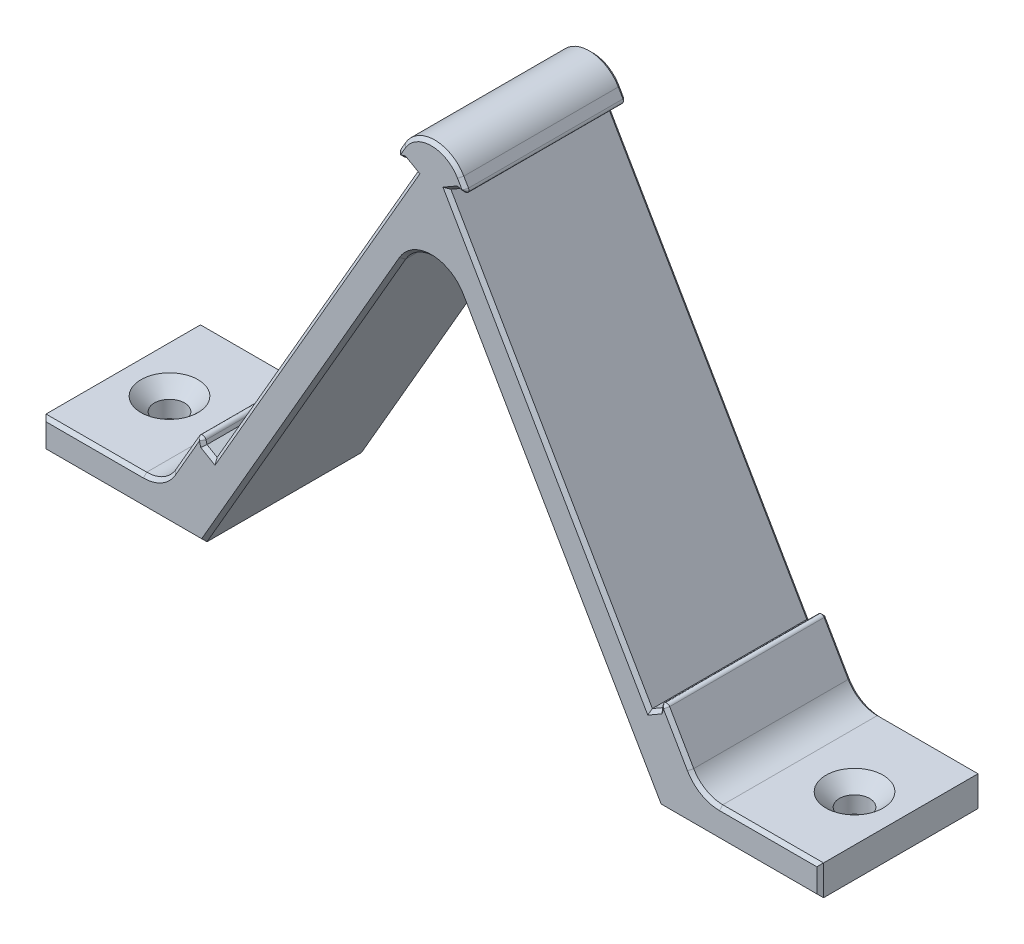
SolidWorks part; units mm, degrees
ref_plane "Plan de face" through (0, 0, 0) normal (0, 0, 1) x (1, 0, 0)
ref_plane "Plan de dessus" through (0, 0, 0) normal (0, 1, 0) x (1, 0, 0)
ref_plane "Plan de droite" through (0, 0, 0) normal (1, 0, 0) x (0, 0, -1)
sketch "Esquisse1" plane through (0, 0, 0) normal (0, 0, 1) x (1, 0, 0)
  line L0 (-38.5566, -6.1929) -> (-34.9786, 0.0045)
  line L1 (0, 60.5892) -> (0, 0) construction
  line L2 (17.4019, 24.4482) -> (23.4641, 27.9482) construction
  line L3 (39.3301, 2.4674) -> (2.4019, 50.4289) construction
  line L4 (-42.8868, -8.6929) -> (-57.8868, -8.6929)
  line L5 (9.3301, 54.4289) -> (32.4019, -1.5326) construction
  line L6 (-5.0214, 51.8918) -> (-4.3301, 53.0892)
  line L7 (33.9175, -0.6576) -> (32.4019, -1.5326)
  line L8 (-2.4019, 50.4289) -> (-32.4019, -1.5326)
  line L9 (-9.3301, 54.4289) -> (-32.4019, -1.5326) construction
  line L10 (-39.3301, 2.4674) -> (-2.4019, 50.4289) construction
  line L11 (-33.9175, -0.6576) -> (-34.0626, -0.116)
  line L12 (-17.4019, 24.4482) -> (-23.4641, 27.9482) construction
  line L13 (-3.9175, 51.3039) -> (-4.459, 51.1588)
  line L14 (-3.9175, 51.3039) -> (-2.4019, 50.4289)
  line L15 (-33.9175, -0.6576) -> (-32.4019, -1.5326)
  line L16 (3.9175, 51.3039) -> (2.4019, 50.4289)
  line L17 (3.9175, 51.3039) -> (4.459, 51.1588)
  line L18 (33.9175, -0.6576) -> (34.0626, -0.116)
  line L19 (2.4019, 50.4289) -> (32.4019, -1.5326)
  line L20 (5.0214, 51.8918) -> (4.3301, 53.0892)
  line L21 (42.8868, -8.6929) -> (57.8868, -8.6929)
  line L22 (38.5566, -6.1929) -> (34.9786, 0.0045)
  line L23 (-57.8868, -8.6929) -> (-57.8868, -13.1854)
  line L24 (-57.8868, -13.1854) -> (-33.9175, -13.1854)
  line L25 (-33.9175, -13.1854) -> (-4.3301, 38.0614)
  line L26 (4.3301, 38.0614) -> (33.9175, -13.1854)
  line L27 (33.9175, -13.1854) -> (57.8868, -13.1854)
  line L28 (57.8868, -13.1854) -> (57.8868, -8.6929)
  arc A0 (42.8868, -8.6929) -> (38.5566, -6.1929) centre (42.8868, -3.6929) cw
  arc A1 (-38.5566, -6.1929) -> (-42.8868, -8.6929) centre (-42.8868, -3.6929) cw
  arc A2 (4.3301, 53.0892) -> (-4.3301, 53.0892) centre (0, 50.5892) ccw
  arc A3 (-4.3301, 38.0614) -> (4.3301, 38.0614) centre (0, 35.5614) cw
  arc A4 (-34.0626, -0.116) -> (-34.9786, 0.0045) centre (-34.5455, -0.2455) ccw
  arc A5 (-5.0214, 51.8918) -> (-4.459, 51.1588) centre (-4.5884, 51.6418) ccw
  arc A6 (5.0214, 51.8918) -> (4.459, 51.1588) centre (4.5884, 51.6418) cw
  arc A7 (34.9786, 0.0045) -> (34.0626, -0.116) centre (34.5455, -0.2455) ccw
  point P7 (-20.866, 26.4482)
  point P28 (20.866, 26.4482)
  point P31 (40, -8.6929)
  point P34 (-40, -8.6929)
  point P45 (0, 45.5614)
  point P48 (-34.375, 1.0499)
  point P51 (-5.625, 50.8464)
  point P54 (5.625, 50.8464)
  point P57 (34.375, 1.0499)
  dimension "D2" = 5
  dimension "D8" = 5
  dimension "D9" = 0.5
  dimension "D10" = 0.5
  dimension "D11" = 0.5
  dimension "D12" = 0.5
  dimension "D1" = 80
  dimension "D3" = 60
  dimension "D4" = 3
  dimension "D5" = 1.75
  dimension "D6" = 45
  dimension "D7" = 40
  dimension "D13" = 15
extrude "Boss.-Extru.1" add sketch "Esquisse1" along normal mid plane 24
sketch "Esquisse2" plane through (0, -8.6929, 0) normal (0, 1, 0) x (1, 0, 0)
  line L0 (0, 0) -> (0, 27.2446) construction
  circle A0 centre (-51, 0) radius 2.25
  circle A1 centre (51, 0) radius 2.25
  dimension "D1" = 4.5
  dimension "D2" = 102
extrude "Enlèv. mat.-Extru.1" cut sketch "Esquisse2" against normal blind 24
chamfer "Chanfrein1" distance 2 angle 45 2 edges at (51, -8.6929, -2.25) (-51, -8.6929, 2.25)
chamfer "Chanfrein3" distance 0.5 angle 45 60 edges at (-45.9021, -13.1854, -12) (-19.1238, 12.438, -12) (0, 40.5614, -12) (19.1238, 12.438, -12) (45.9021, -13.1854, -12) (57.8868, -10.9391, -12) (50.3868, -8.6929, -12) (40.3868, -8.023, -12) (36.7676, -3.0942, -12) (34.4803, 0.2503, -12) (33.99, -0.3868, -12) (33.1597, -1.0951, -12) (17.4019, 24.4482, -12) (3.1597, 50.8664, -12) (4.1882, 51.2314, -12) (4.9851, 51.3374, -12) (4.6758, 52.4905, -12) (0, 55.5892, -12) (-4.6758, 52.4905, -12) (-4.9851, 51.3374, -12) (-4.1882, 51.2314, -12) (-3.1597, 50.8664, -12) (-17.4019, 24.4482, -12) (-33.1597, -1.0951, -12) (-33.99, -0.3868, -12) (-34.4803, 0.2503, -12) (-36.7676, -3.0942, -12) (-40.3868, -8.023, -12) (-50.3868, -8.6929, -12) (-57.8868, -10.9391, -12) (-50.3868, -8.6929, 12) (-40.3868, -8.023, 12) (-36.7676, -3.0942, 12) (-34.4803, 0.2503, 12) (-33.99, -0.3868, 12) (-33.1597, -1.0951, 12) (-17.4019, 24.4482, 12) (-3.1597, 50.8664, 12) (-4.1882, 51.2314, 12) (-4.9851, 51.3374, 12) (-4.6758, 52.4905, 12) (0, 55.5892, 12) (4.6758, 52.4905, 12) (4.9851, 51.3374, 12) (4.1882, 51.2314, 12) (3.1597, 50.8664, 12) (17.4019, 24.4482, 12) (33.1597, -1.0951, 12) (33.99, -0.3868, 12) (34.4803, 0.2503, 12) (36.7676, -3.0942, 12) (40.3868, -8.023, 12) (50.3868, -8.6929, 12) (57.8868, -10.9391, 12) (45.9021, -13.1854, 12) (19.1238, 12.438, 12) (0, 40.5614, 12) (-19.1238, 12.438, 12) (-45.9021, -13.1854, 12) (-57.8868, -10.9391, 12)
